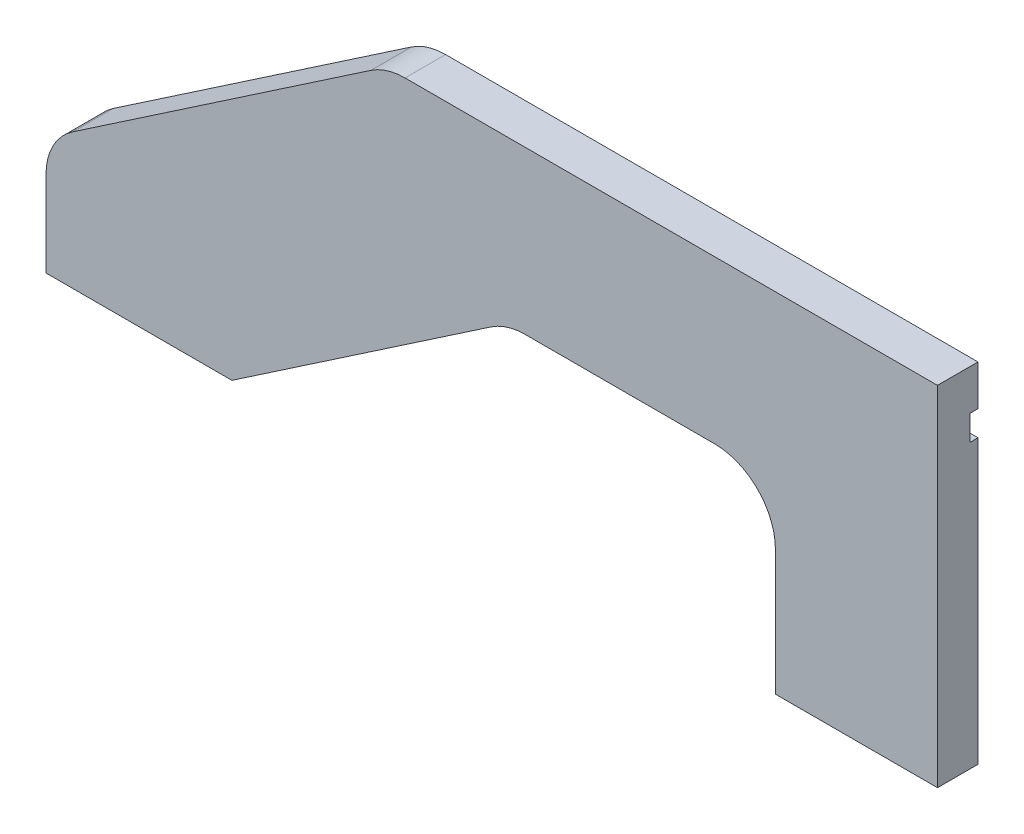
SolidWorks part; units mm, degrees
ref_plane "Plan de face" through (0, 0, 0) normal (0, 0, 1) x (1, 0, 0)
ref_plane "Plan de dessus" through (0, 0, 0) normal (0, 1, 0) x (1, 0, 0)
ref_plane "Plan de droite" through (0, 0, 0) normal (1, 0, 0) x (0, 0, -1)
sketch "Esquisse1" plane through (0, 0, 0) normal (0, 0, 1) x (1, 0, 0)
  line L0 (145.5379, -45.3129) -> (-74.4621, -45.3129)
  line L1 (-74.4621, -45.3129) -> (-74.4621, -16.3136)
  line L2 (-74.4621, -16.3136) -> (9.5379, 40.6871)
  line L3 (9.5379, 40.6871) -> (145.5379, 40.6871)
  line L4 (145.5379, 40.6871) -> (145.5379, -45.3129)
  dimension "D1" = 86
  dimension "D2" = 136
  dimension "D3" = 220
  dimension "D4" = 124.16
extrude "Extrusion1" add sketch "Esquisse1" along normal blind 10
sketch "Esquisse2" plane through (0, 0, 0) normal (0, 0, -1) x (-1, 0, 0)
  line L0 (-145.5379, -45.3129) -> (-145.5379, 40.6871) construction
  line L1 (-145.5379, 30.6871) -> (-19.5379, 30.6871)
  line L2 (-145.5379, 30.6871) -> (-145.5379, 24.4871)
  line L3 (-145.5379, 24.4871) -> (-19.5379, 24.4871)
  line L4 (-19.5379, 30.6871) -> (-19.5379, 24.4871)
  line L6 (8.4621, 5.4871) -> (-21.5379, 5.4871)
  line L7 (8.4621, 5.4871) -> (8.4621, 11.6871)
  line L8 (8.4621, 11.6871) -> (-21.5379, 11.6871)
  line L9 (-21.5379, 5.4871) -> (-21.5379, 11.6871)
  line L10 (6.4621, -7.3129) -> (36.4621, -7.3129)
  line L11 (6.4621, -7.3129) -> (6.4621, -13.5129)
  line L12 (6.4621, -13.5129) -> (36.4621, -13.5129)
  line L13 (36.4621, -7.3129) -> (36.4621, -13.5129)
  line L14 (74.4621, -45.3129) -> (-145.5379, -45.3129) construction
  line L15 (34.4621, -26.3129) -> (64.4621, -26.3129)
  line L16 (34.4621, -26.3129) -> (34.4621, -32.5129)
  line L17 (34.4621, -32.5129) -> (64.4621, -32.5129)
  line L18 (64.4621, -26.3129) -> (64.4621, -32.5129)
  line L19 (-145.5379, 40.6871) -> (-9.5379, 40.6871) construction
  dimension "D1" = 126
  dimension "D2" = 6.2
  dimension "D3" = 19
  dimension "D4" = 30
  dimension "D5" = 6.2
  dimension "D6" = 6.2
  dimension "D7" = 30
  dimension "D8" = 28
  dimension "D9" = 28
  dimension "D10" = 19
  dimension "D11" = 19
  dimension "D12" = 30
  dimension "D13" = 28
  dimension "D14" = 6.2
  dimension "D15" = 19
  dimension "D16" = 10
extrude "Enlèv. mat.-Extru.1" cut sketch "Esquisse2" against normal blind 2
sketch "Esquisse3" plane through (0, 0, 0) normal (0, 0, -1) x (-1, 0, 0)
  line L0 (-105.5379, -45.3129) -> (-105.5379, 0.6871)
  line L1 (74.4621, -45.3129) -> (-145.5379, -45.3129) construction
  line L2 (-105.5379, 0.6871) -> (-39.201, 0.6871)
  line L3 (-39.201, 0.6871) -> (28.5877, -45.3129)
  line L5 (-145.5379, -45.3129) -> (-145.5379, 24.4871) construction
  line L7 (28.5877, -45.3129) -> (-105.5379, -45.3129)
  line L12 (-145.5379, 40.6871) -> (-9.5379, 40.6871) construction
  dimension "D1" = 40
  dimension "D2" = 40
  dimension "D3" = 34.16
  dimension "D4" = 13.89
extrude "Enlèv. mat.-Extru.3" cut sketch "Esquisse3" against normal through all
fillet "Congé1" radius 15 4 edges at (105.5379, 0.6871, 5) (39.201, 0.6871, 5) (-74.4621, -16.3136, 5) (9.5379, 40.6871, 5)
sketch "Esquisse4" plane through (0, 0, 0) normal (0, 0, -1) x (-1, 0, 0)
  line L0 (64.4621, -32.5129) -> (64.4621, -26.3129) construction
  line L1 (34.4621, -32.5129) -> (64.4621, -32.5129) construction
  line L2 (64.4621, -26.3129) -> (34.4621, -26.3129) construction
  line L3 (49.4621, -20) -> (49.4621, -40) construction
  line L4 (34.4621, -26.3129) -> (34.4621, -32.5129) construction
  line L5 (36.4621, -7.3129) -> (6.4621, -7.3129) construction
  line L6 (6.4621, -13.5129) -> (36.4621, -13.5129) construction
  line L7 (36.4621, -13.5129) -> (36.4621, -7.3129) construction
  line L8 (21.4621, 0) -> (21.4621, -20) construction
  line L9 (6.4621, -7.3129) -> (6.4621, -13.5129) construction
  line L10 (8.4621, 5.4871) -> (8.4621, 11.6871) construction
  line L11 (8.4621, 11.6871) -> (-21.5379, 11.6871) construction
  line L12 (-21.5379, 5.4871) -> (8.4621, 5.4871) construction
  line L13 (-6.5379, 20) -> (-6.5379, 0) construction
  line L14 (-21.5379, 11.6871) -> (-21.5379, 5.4871) construction
  line L15 (-19.5379, 24.4871) -> (-19.5379, 30.6871) construction
  line L16 (-19.5379, 30.6871) -> (-145.5379, 30.6871) construction
  line L17 (-145.5379, 24.4871) -> (-19.5379, 24.4871) construction
  circle A0 centre (63.3621, -27.4129) radius 1.6
  circle A1 centre (63.3621, -31.4129) radius 1.6
  circle A2 centre (35.5621, -31.4129) radius 1.6
  circle A3 centre (35.5621, -27.4129) radius 1.6
  circle A4 centre (35.3621, -8.4129) radius 1.6
  circle A5 centre (35.3621, -12.4129) radius 1.6
  circle A6 centre (7.5621, -12.4129) radius 1.6
  circle A7 centre (7.5621, -8.4129) radius 1.6
  circle A8 centre (7.3621, 10.5871) radius 1.6
  circle A9 centre (7.3621, 6.5871) radius 1.6
  circle A10 centre (-20.4379, 6.5871) radius 1.6
  circle A11 centre (-20.4379, 10.5871) radius 1.6
  circle A12 centre (-20.6379, 29.5871) radius 1.6
  circle A13 centre (-20.6379, 25.5871) radius 1.6
  point P12 (34.4621, -29.4129)
  dimension "D1" = 1.1
  dimension "D6" = 1.1
  dimension "D11" = 1.1
  dimension "D16" = 1.1
  dimension "D2" = 1.1
  dimension "D3" = 1.1
  dimension "D4" = 1.1
  dimension "D5" = 15
  dimension "D7" = 1.1
  dimension "D8" = 1.1
  dimension "D9" = 1.1
  dimension "D10" = 15
  dimension "D12" = 1.1
  dimension "D13" = 1.1
  dimension "D14" = 1.1
  dimension "D15" = 15
  dimension "D17" = 1.1
  dimension "D18" = 1.1
  dimension "D19" = 1.1
extrude "Enlèv. mat.-Extru.4" cut sketch "Esquisse4" against normal blind 2
